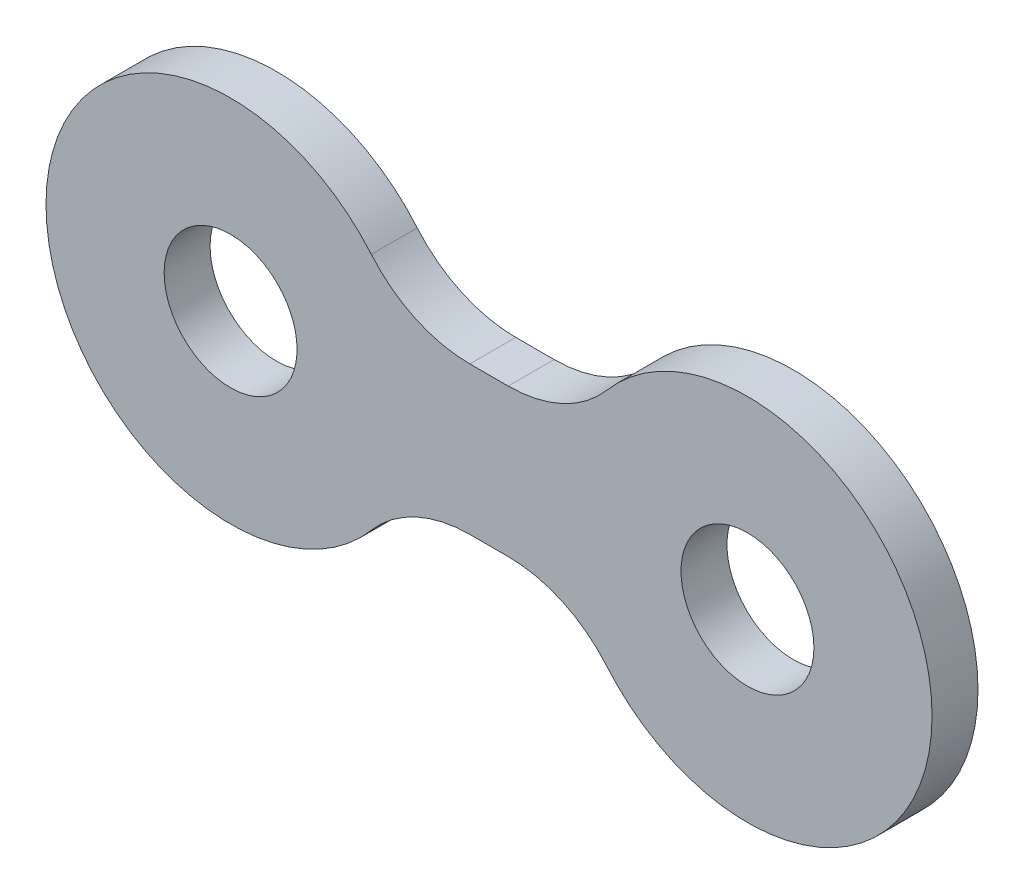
SolidWorks part; units mm, degrees
ref_plane "Front Plane" through (0, 0, 0) normal (0, 0, 1) x (1, 0, 0)
ref_plane "Top Plane" through (0, 0, 0) normal (0, 1, 0) x (1, 0, 0)
ref_plane "Right Plane" through (0, 0, 0) normal (1, 0, 0) x (0, 0, -1)
sketch "Sketch1" plane through (0, 0, 0) normal (0, 0, 1) x (1, 0, 0)
  line L0 (0, 0) -> (0, 19.2547) construction
  line L1 (-2.4174, 2) -> (2.4174, 2)
  line L2 (-2.4174, -2) -> (2.4174, -2)
  line L3 (-7, 0) -> (7, 0) construction
  arc A0 (-2.4174, 2) -> (-2.4174, -2) centre (-7, 0) ccw
  arc A1 (2.4174, 2) -> (2.4174, -2) centre (7, 0) cw
  circle A2 centre (7, 0) radius 1.8
  circle A3 centre (-7, 0) radius 1.8
  point P8 (0, 2)
  point P11 (0, -2)
  dimension "D1" = 3.6
  dimension "D2" = 5
  dimension "D3" = 14
  dimension "D4" = 4
extrude "Boss-Extrude1" add sketch "Sketch1" along normal blind 1.2446
fillet "Fillet1" radius 3.5 4 edges at (2.4174, -2, 0.6223) (-2.4174, -2, 0.6223) (2.4174, 2, 0.6223) (-2.4174, 2, 0.6223)
